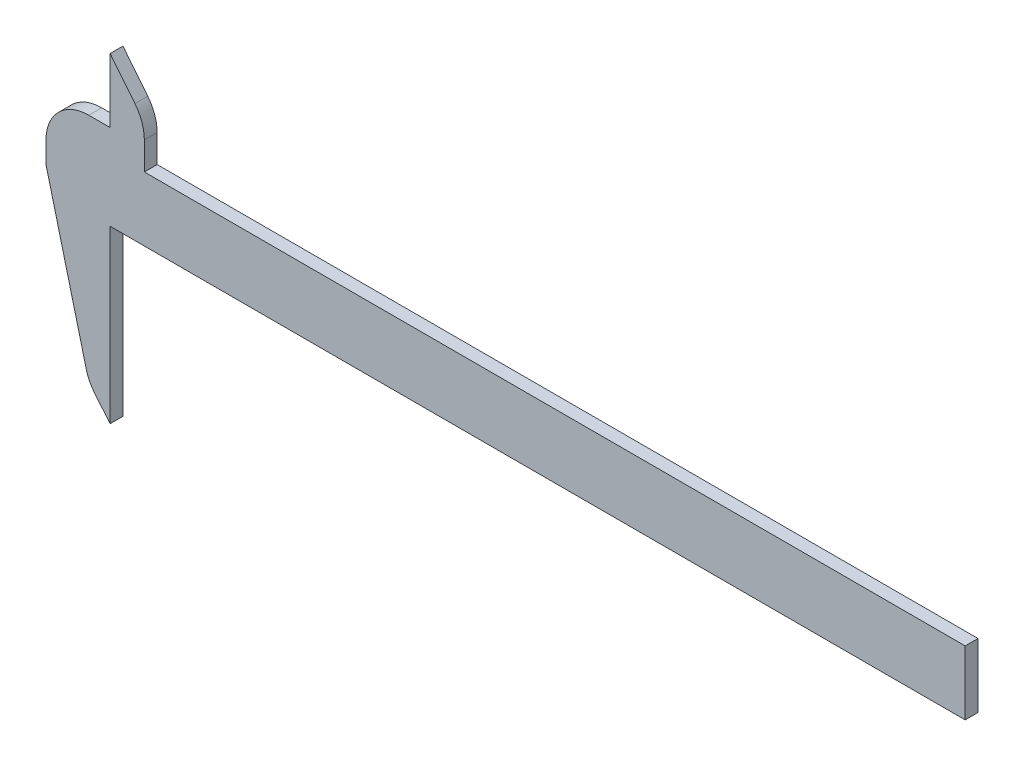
SolidWorks part; units mm, degrees
ref_plane "Plan de face" through (0, 0, 0) normal (0, 0, 1) x (1, 0, 0)
ref_plane "Plan de dessus" through (0, 0, 0) normal (0, 1, 0) x (1, 0, 0)
ref_plane "Plan de droite" through (0, 0, 0) normal (1, 0, 0) x (0, 0, -1)
sketch "Esquisse1" plane through (0, 0, 0) normal (0, 0, 1) x (1, 0, 0)
  line L0 (0, 0) -> (200, 0)
  line L1 (200, 0) -> (200, 15)
  line L2 (200, 15) -> (8, 15)
  line L3 (8, 15) -> (8, 25)
  line L4 (8, 25) -> (0, 35)
  line L5 (0, 35) -> (0, 20)
  line L6 (0, 20) -> (-15, 20)
  line L7 (-15, 20) -> (-15, 5)
  line L8 (-15, 5) -> (-5, -34)
  line L9 (-5, -34) -> (0, -40)
  line L10 (0, -40) -> (0, 0)
  dimension "D1" = 200
  dimension "D2" = 40
  dimension "D3" = 20
  dimension "D4" = 15
  dimension "D5" = 8
  dimension "D6" = 10
  dimension "D7" = 5
  dimension "D8" = 15
  dimension "D9" = 15
  dimension "D10" = 6
  dimension "D11" = 5
extrude "Boss.-Extru.1" add sketch "Esquisse1" along normal blind 3
sketch "Esquisse2" plane through (0, 0, 3) normal (0, 0, 1) x (1, 0, 0)
  line L0 (9, 3) -> (9, 8)
  line L1 (10, 3) -> (10, 6)
  line L2 (11, 3) -> (11, 6)
  line L3 (12, 3) -> (12, 6)
  line L4 (13, 3) -> (13, 6)
  line L5 (14, 3) -> (14, 7)
  line L6 (15, 3) -> (15, 6)
  line L7 (16, 3) -> (16, 6)
  line L8 (17, 3) -> (17, 6)
  line L9 (18, 3) -> (18, 6)
  line L10 (10, 2) -> (26.6923, 2) construction
  line L11 (19, 3) -> (19, 8)
  line L12 (20, 3) -> (20, 6)
  line L13 (21, 3) -> (21, 6)
  line L14 (22, 3) -> (22, 6)
  line L15 (23, 3) -> (23, 6)
  line L16 (24, 3) -> (24, 7)
  line L17 (25, 3) -> (25, 6)
  line L18 (26, 3) -> (26, 6)
  line L19 (27, 3) -> (27, 6)
  line L20 (28, 3) -> (28, 6)
  line L21 (29, 3) -> (29, 8)
  line L22 (30, 3) -> (30, 6)
  line L23 (31, 3) -> (31, 6)
  line L24 (32, 3) -> (32, 6)
  line L25 (33, 3) -> (33, 6)
  line L26 (34, 3) -> (34, 7)
  line L27 (35, 3) -> (35, 6)
  line L28 (36, 3) -> (36, 6)
  line L29 (37, 3) -> (37, 6)
  line L30 (38, 3) -> (38, 6)
  line L31 (39, 3) -> (39, 8)
  line L32 (40, 3) -> (40, 6)
  line L33 (41, 3) -> (41, 6)
  line L34 (42, 3) -> (42, 6)
  line L35 (43, 3) -> (43, 6)
  line L36 (44, 3) -> (44, 7)
  line L37 (45, 3) -> (45, 6)
  line L38 (46, 3) -> (46, 6)
  line L39 (47, 3) -> (47, 6)
  line L40 (48, 3) -> (48, 6)
  line L41 (49, 3) -> (49, 8)
  line L42 (50, 3) -> (50, 6)
  line L43 (51, 3) -> (51, 6)
  line L44 (52, 3) -> (52, 6)
  line L45 (53, 3) -> (53, 6)
  line L46 (54, 3) -> (54, 7)
  line L47 (55, 3) -> (55, 6)
  line L48 (56, 3) -> (56, 6)
  line L49 (57, 3) -> (57, 6)
  line L50 (58, 3) -> (58, 6)
  line L51 (59, 3) -> (59, 8)
  line L52 (60, 3) -> (60, 6)
  line L53 (61, 3) -> (61, 6)
  line L54 (62, 3) -> (62, 6)
  line L55 (63, 3) -> (63, 6)
  line L56 (64, 3) -> (64, 7)
  line L57 (65, 3) -> (65, 6)
  line L58 (66, 3) -> (66, 6)
  line L59 (67, 3) -> (67, 6)
  line L60 (68, 3) -> (68, 6)
  line L61 (69, 3) -> (69, 8)
  line L62 (70, 3) -> (70, 6)
  line L63 (71, 3) -> (71, 6)
  line L64 (72, 3) -> (72, 6)
  line L65 (73, 3) -> (73, 6)
  line L66 (74, 3) -> (74, 7)
  line L67 (75, 3) -> (75, 6)
  line L68 (76, 3) -> (76, 6)
  line L69 (77, 3) -> (77, 6)
  line L70 (78, 3) -> (78, 6)
  line L71 (79, 3) -> (79, 8)
  line L72 (80, 3) -> (80, 6)
  line L73 (81, 3) -> (81, 6)
  line L74 (82, 3) -> (82, 6)
  line L75 (83, 3) -> (83, 6)
  line L76 (84, 3) -> (84, 7)
  line L77 (85, 3) -> (85, 6)
  line L78 (86, 3) -> (86, 6)
  line L79 (87, 3) -> (87, 6)
  line L80 (88, 3) -> (88, 6)
  line L81 (89, 3) -> (89, 8)
  line L82 (90, 3) -> (90, 6)
  line L83 (91, 3) -> (91, 6)
  line L84 (92, 3) -> (92, 6)
  line L85 (93, 3) -> (93, 6)
  line L86 (94, 3) -> (94, 7)
  line L87 (95, 3) -> (95, 6)
  line L88 (96, 3) -> (96, 6)
  line L89 (97, 3) -> (97, 6)
  line L90 (98, 3) -> (98, 6)
  line L91 (99, 3) -> (99, 8)
  line L92 (100, 3) -> (100, 6)
  line L93 (101, 3) -> (101, 6)
  line L94 (102, 3) -> (102, 6)
  line L95 (103, 3) -> (103, 6)
  line L96 (104, 3) -> (104, 7)
  line L97 (105, 3) -> (105, 6)
  line L98 (106, 3) -> (106, 6)
  line L99 (107, 3) -> (107, 6)
  line L100 (108, 3) -> (108, 6)
  line L101 (109, 3) -> (109, 8)
  line L102 (110, 3) -> (110, 6)
  line L103 (111, 3) -> (111, 6)
  line L104 (112, 3) -> (112, 6)
  line L105 (113, 3) -> (113, 6)
  line L106 (114, 3) -> (114, 7)
  line L107 (115, 3) -> (115, 6)
  line L108 (116, 3) -> (116, 6)
  line L109 (117, 3) -> (117, 6)
  line L110 (118, 3) -> (118, 6)
  line L111 (119, 3) -> (119, 8)
  line L112 (120, 3) -> (120, 6)
  line L113 (121, 3) -> (121, 6)
  line L114 (122, 3) -> (122, 6)
  line L115 (123, 3) -> (123, 6)
  line L116 (124, 3) -> (124, 7)
  line L117 (125, 3) -> (125, 6)
  line L118 (126, 3) -> (126, 6)
  line L119 (127, 3) -> (127, 6)
  line L120 (128, 3) -> (128, 6)
  line L121 (129, 3) -> (129, 8)
  line L122 (130, 3) -> (130, 6)
  line L123 (131, 3) -> (131, 6)
  line L124 (132, 3) -> (132, 6)
  line L125 (133, 3) -> (133, 6)
  line L126 (134, 3) -> (134, 7)
  line L127 (135, 3) -> (135, 6)
  line L128 (136, 3) -> (136, 6)
  line L129 (137, 3) -> (137, 6)
  line L130 (138, 3) -> (138, 6)
  line L131 (139, 3) -> (139, 8)
  line L132 (140, 3) -> (140, 6)
  line L133 (141, 3) -> (141, 6)
  line L134 (142, 3) -> (142, 6)
  line L135 (143, 3) -> (143, 6)
  line L136 (144, 3) -> (144, 7)
  line L137 (145, 3) -> (145, 6)
  line L138 (146, 3) -> (146, 6)
  line L139 (147, 3) -> (147, 6)
  line L140 (148, 3) -> (148, 6)
  line L141 (149, 3) -> (149, 8)
  line L142 (150, 3) -> (150, 6)
  line L143 (151, 3) -> (151, 6)
  line L144 (152, 3) -> (152, 6)
  line L145 (153, 3) -> (153, 6)
  line L146 (154, 3) -> (154, 7)
  line L147 (155, 3) -> (155, 6)
  line L148 (156, 3) -> (156, 6)
  line L149 (157, 3) -> (157, 6)
  line L150 (158, 3) -> (158, 6)
  line L151 (159, 3) -> (159, 8)
  line L152 (160, 3) -> (160, 6)
  line L153 (161, 3) -> (161, 6)
  line L154 (162, 3) -> (162, 6)
  line L155 (163, 3) -> (163, 6)
  line L156 (164, 3) -> (164, 7)
  line L157 (165, 3) -> (165, 6)
  line L158 (166, 3) -> (166, 6)
  line L159 (167, 3) -> (167, 6)
  line L160 (168, 3) -> (168, 6)
  line L161 (169, 3) -> (169, 8)
  line L162 (170, 3) -> (170, 6)
  line L163 (171, 3) -> (171, 6)
  line L164 (172, 3) -> (172, 6)
  line L165 (173, 3) -> (173, 6)
  line L166 (174, 3) -> (174, 7)
  line L167 (175, 3) -> (175, 6)
  line L168 (176, 3) -> (176, 6)
  line L169 (177, 3) -> (177, 6)
  line L170 (178, 3) -> (178, 6)
  line L171 (179, 3) -> (179, 8)
  line L172 (180, 3) -> (180, 6)
  line L173 (181, 3) -> (181, 6)
  line L174 (182, 3) -> (182, 6)
  line L175 (183, 3) -> (183, 6)
  line L176 (184, 3) -> (184, 7)
  line L177 (185, 3) -> (185, 6)
  line L178 (186, 3) -> (186, 6)
  line L179 (187, 3) -> (187, 6)
  line L180 (188, 3) -> (188, 6)
  line L182 (0, -40) -> (0, 0) construction
  dimension "D1" = 5
  dimension "D2" = 3
  dimension "D3" = 4
  dimension "D4" = 1
  dimension "D5" = 1
  dimension "D6" = 1
  dimension "D7" = 1
  dimension "D8" = 1
  dimension "D9" = 1
  dimension "D10" = 1
  dimension "D11" = 1
  dimension "D12" = 1
  dimension "D13" = 1
  dimension "D15" = 9
  dimension "D14" = 18
fillet "Congé1" radius 10 1 edges at (-15, 20, 1.5)
fillet "Congé2" radius 10 1 edges at (-5, -34, 1.5)
fillet "Congé3" radius 10 1 edges at (8, 25, 1.5)
sketch "Esquisse3" plane through (0, 0, 3) normal (0, 0, 1) x (1, 0, 0)
  text T9 "0     1     2     3     4      5     6     7     8     9    10   11    12   13   14   15   16   17" font "Century Gothic" height 3.65
